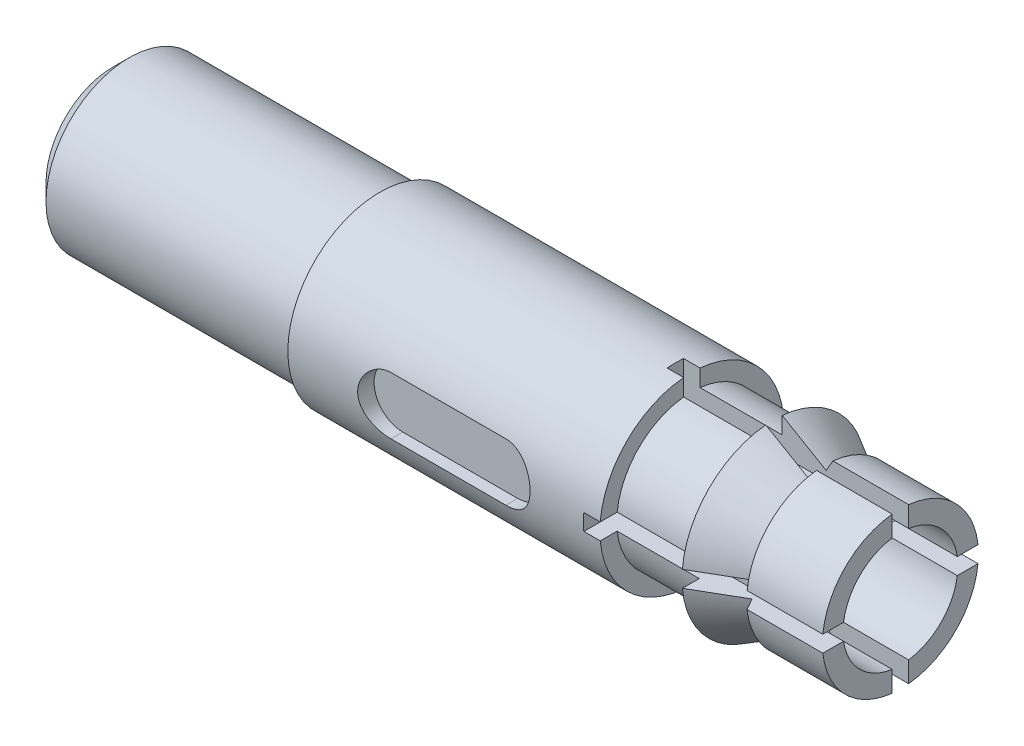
SolidWorks part; units mm, degrees
ref_plane "Plan de face" through (0, 0, 0) normal (0, 0, 1) x (1, 0, 0)
ref_plane "Plan de dessus" through (0, 0, 0) normal (0, 1, 0) x (1, 0, 0)
ref_plane "Plan de droite" through (0, 0, 0) normal (1, 0, 0) x (0, 0, -1)
sketch "Esquisse1" plane through (0, 0, 0) normal (0, 0, 1) x (1, 0, 0)
  line L0 (-23.975, 0) -> (23.975, 0) construction
  line L1 (-23.975, 0) -> (-23.975, 5.075)
  line L2 (-23.975, 5.075) -> (-7.725, 5.075)
  line L3 (-7.725, 5.075) -> (-7.725, 5.6)
  line L4 (-7.725, 5.6) -> (11.275, 5.6)
  line L5 (11.275, 5.6) -> (11.275, 4.575)
  line L6 (11.275, 4.575) -> (16.275, 4.575)
  line L7 (16.275, 4.575) -> (16.275, 5.6)
  line L8 (16.275, 5.6) -> (18.9597, 4.05)
  line L9 (18.9597, 4.05) -> (19.3638, 4.75)
  line L10 (19.3638, 4.75) -> (23.975, 4.75)
  line L11 (23.975, 4.75) -> (23.975, 0)
  line L12 (-23.975, 3.5) -> (23.975, 3.5)
  point P2 (23.975, 2.375)
  dimension "D1" = 10.15
  dimension "D2" = 12.7
  dimension "D3" = 19
  dimension "D4" = 16.25
  dimension "D5" = 11.2
  dimension "D6" = 9.15
  dimension "D7" = 8.1
  dimension "D8" = 9.5
  dimension "D9" = 5
  dimension "D10" = 60
  dimension "D11" = 7
revolve "Révolution1" add sketch "Esquisse1" angle 360 about L0
sketch "Esquisse2" plane through (23.975, 0, 0) normal (1, 0, 0) x (0, 0, -1)
  line L1 (0.5, -5.6) -> (-0.5, -5.6)
  line L2 (0.5, -5.6) -> (0.5, 5.6)
  line L3 (0.5, 5.6) -> (-0.5, 5.6)
  line L4 (-0.5, -5.6) -> (-0.5, 5.6)
  line L5 (0.5, -5.6) -> (-0.5, 5.6) construction
  line L6 (0.5, 5.6) -> (-0.5, -5.6) construction
  circle A0 centre (0, 0) radius 5.6 construction
  circle A1 centre (0, 0) radius 5.6 construction
  point P0 (0, 0)
  dimension "D1" = 1
extrude "Enlèv. mat.-Extru.1" cut sketch "Esquisse2" against normal offset from surface (13.7 mm away) 1
pattern_circular "Répétition circulaire1" count 2 every 90 about axis through (-23.975, 0, 0) along (-1, 0, 0) of "Enlèv. mat.-Extru.1"
ref_plane "Plan2" through (0, 0, 5.6) normal (0, 0, 1) x (-1, 0, 0)
sketch "Esquisse7" plane through (0, 0, 5.6) normal (0, 0, 1) x (-1, 0, 0)
  line L0 (-5.275, 0) -> (1.725, 0) construction
  line L1 (-5.275, 1.75) -> (1.725, 1.75)
  line L2 (-5.275, -1.75) -> (1.725, -1.75)
  line L4 (-11.275, 5.5776) -> (7.725, 5.6) construction
  arc A0 (-5.275, 1.75) -> (-5.275, -1.75) centre (-5.275, 0) ccw
  arc A1 (1.725, -1.75) -> (1.725, 1.75) centre (1.725, 0) ccw
  point P3 (-1.775, 0)
  point P13 (-1.775, 5.5888)
  dimension "D1" = 7
  dimension "D2" = 3.5
extrude "Enlèv. mat.-Extru.2" cut sketch "Esquisse7" against normal blind 1 contours L2 A1 L1 A0
ref_plane "Plan3" through (1.775, 0, 0) normal (1, 0, 0) x (0, 0, -1)
ref_plane "Plan4" through (0, 0, 0) normal (0, -1, 0) x (-1, 0, 0)
thread "Filetage3" pitch 0.25 start angle 0, offset 0, length 0, pitch 0.25, diameter 9.5
ref_plane "Plan6" through (23.975, 0, 4.75) normal (0, -1, 0) x (0, 0, 1)
sketch "Profil de filetage3" plane through (23.975, 0, 4.75) normal (0, -1, 0) x (0, 0, 1)
  line L0 (0, 0) -> (0, 0.25) construction
  line L11 (0, 0) -> (0, 0.2187)
  line L12 (0, 0.2187) -> (-0.1353, 0.1406)
  line L13 (-0.1353, 0.1406) -> (-0.1353, 0.0781)
  line L15 (-0.1353, 0.0781) -> (0, 0)
  line L17 (-0.1353, 0.1094) -> (0, 0.1094) construction
  point P2 (0, 0)
  dimension "Pitch" = 0.25
  dimension "Profile_Angle" = 60
  dimension "Profile_Land" = 0.0625
  dimension "Profile_Height" = 0.1353
thread "Filetage1" pitch 0.25 start angle 0, offset 0, length 20, pitch 0.25, diameter 7
ref_plane "Plan1" through (23.975, 0, -3.5) normal (0, -1, 0) x (0, 0, -1)
sketch "Profil de filetage1" plane through (23.975, 0, -3.5) normal (0, -1, 0) x (0, 0, -1)
  line L0 (0, 0) -> (0, 0.25) construction
  line L1 (0, 0) -> (0.1353, 0.0781)
  line L2 (0.1353, 0.0781) -> (0.1353, 0.1094)
  line L3 (0.1353, 0.1094) -> (0, 0.1875)
  line L4 (0.1353, 0.0937) -> (0, 0.0937) construction
  line L11 (0, 0) -> (0, 0.1875)
  point P2 (0, 0)
  dimension "Pitch" = 0.25
  dimension "Profile_Angle" = 60
  dimension "Profile_Land" = 0.0312
  dimension "Profile_Height" = 0.1353
chamfer "Chanfrein1" distance 1 angle 45 1 edges at (-23.975, 0, 5.075)
